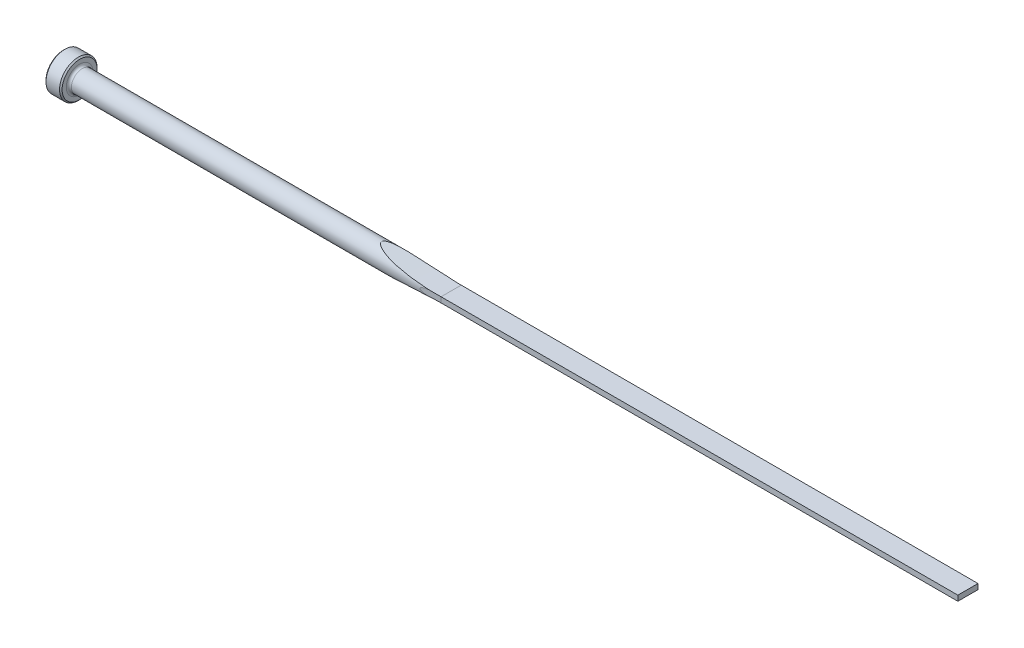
SolidWorks part; units mm, degrees
ref_plane "Front Plane" through (0, 0, 0) normal (0, 0, 1) x (1, 0, 0)
ref_plane "Top Plane" through (0, 0, 0) normal (0, 1, 0) x (1, 0, 0)
ref_plane "Right Plane" through (0, 0, 0) normal (1, 0, 0) x (0, 0, -1)
sketch "Sketch1" plane through (0, 0, 0) normal (0, 0, 1) x (1, 0, 0)
  line L0 (0, 0) -> (175.5286, 0) construction
  line L1 (0, 0) -> (0, 5.5499)
  line L2 (0, 5.5499) -> (4.7498, 5.5499)
  line L3 (4.7498, 5.5499) -> (4.7498, 3.175)
  line L4 (4.7498, 3.175) -> (266.7, 3.175)
  line L5 (266.7, 3.175) -> (266.7, 0)
  line L6 (266.7, 0) -> (0, 0)
  dimension "D1" = 266.7
  dimension "D2" = 11.0998
  dimension "D3" = 6.35
  dimension "D4" = 4.7498
revolve "Revolve1" add sketch "Sketch1" angle 360 about L0
sketch "Sketch2" plane through (0, 0, 0) normal (0, 0, 1) x (1, 0, 0)
  line L0 (266.7, 3.175) -> (266.7, 0.7874)
  line L1 (266.7, -3.175) -> (266.7, 3.175) construction
  line L2 (266.7, 0.7874) -> (114.3, 0.7874)
  line L3 (266.7, 3.175) -> (4.7498, 3.175) construction
  line L4 (93.835, 3.175) -> (266.7, 3.175)
  line L5 (166.0833, 0) -> (153.1705, 0) construction
  arc A0 (114.3, 0.7874) -> (93.835, 3.175) centre (114.3, 89.6874) cw
  dimension "D1" = 88.9
  dimension "D3" = 152.4
  dimension "D2" = 1.5748
  dimension "D4" = 20.465
extrude "Cut-Extrude1" cut sketch "Sketch2" against normal through all both and the other way through all
mirror "Mirror1" about plane through (0, 0, 0) normal (0, 1, 0) of "Cut-Extrude1"
sketch "Sketch3" plane through (0, 0, 0) normal (0, 1, 0) x (1, 0, 0)
  line L0 (266.7, 3.175) -> (266.7, 2.9718)
  line L1 (266.7, 3.0758) -> (266.7, -3.0758) construction
  line L2 (266.7, 2.9718) -> (114.3, 2.9718)
  line L3 (266.7, 3.175) -> (4.7498, 3.175) construction
  line L4 (108.2927, 3.175) -> (266.7, 3.175)
  line L5 (163.4716, 0) -> (166.2513, 0) construction
  line L6 (114.3, 3.0758) -> (114.3, -3.0758) construction
  arc A0 (114.3, 2.9718) -> (108.2927, 3.175) centre (114.3, 91.8718) cw
  dimension "D2" = 88.9
  dimension "D1" = 5.9436
extrude "Cut-Extrude2" cut sketch "Sketch3" against normal through all both and the other way through all
mirror "Mirror2" about plane through (0, 0, 0) normal (0, 0, 1) of "Cut-Extrude2"
fillet "Fillet1" radius 0.762 1 edges at (4.7498, 0, 3.175)
chamfer "Chamfer1" distance 0.381 angle 45 2 edges at (0, 0, 5.5499) (4.7498, 0, 5.5499)
